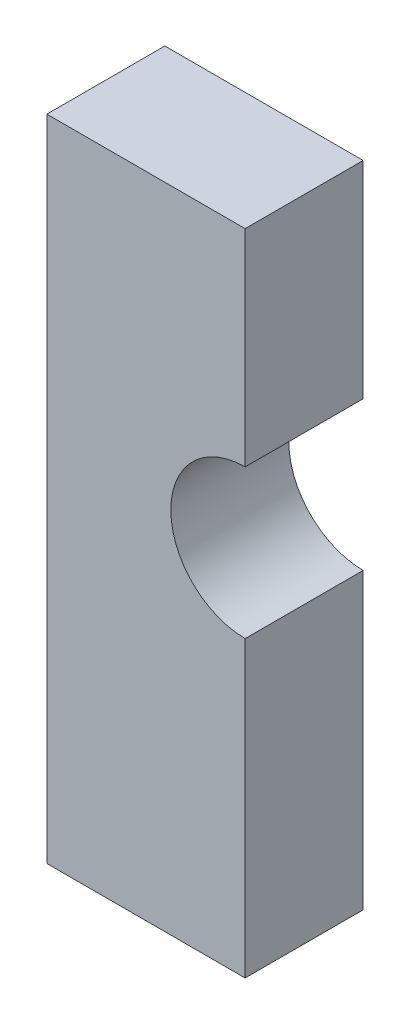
SolidWorks part; units mm, degrees
ref_plane "Front Plane" through (0, 0, 0) normal (0, 0, 1) x (1, 0, 0)
ref_plane "Top Plane" through (0, 0, 0) normal (0, 1, 0) x (1, 0, 0)
ref_plane "Right Plane" through (0, 0, 0) normal (1, 0, 0) x (0, 0, -1)
sketch "Sketch1" plane through (0, 0, 0) normal (0, 0, 1) x (1, 0, 0)
  line L0 (21.3396, 31.639) -> (21.3396, 0)
  line L1 (21.3396, 69.85) -> (0, 69.85)
  line L2 (21.3396, 69.85) -> (21.3396, 47.639)
  line L3 (21.3396, 0) -> (0, 0)
  line L4 (0, 69.85) -> (0, 0)
  arc A0 (21.3396, 47.639) -> (21.3396, 31.639) centre (21.3396, 39.639) ccw
  dimension "D5" = 8
  dimension "D1" = 21.3396
  dimension "D2" = 69.85
  dimension "D3" = 31.639
  dimension "D4" = 22.211
extrude "Boss-Extrude1" add sketch "Sketch1" against normal blind 12.7
